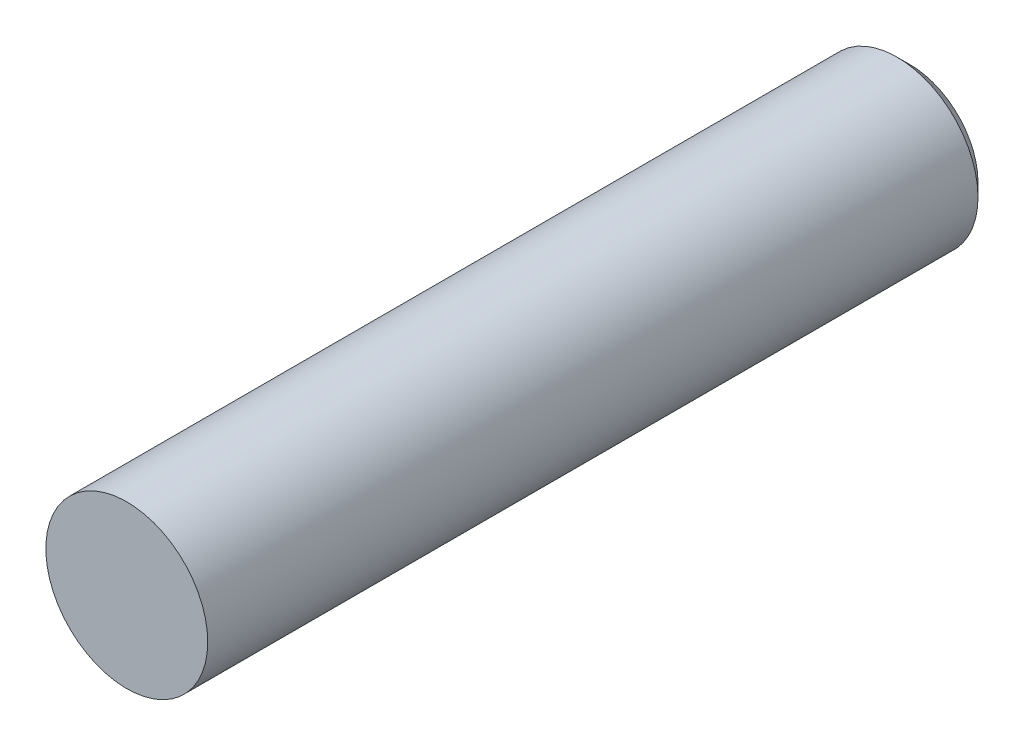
SolidWorks part; units mm, degrees
ref_plane "Plan de face" through (0, 0, 0) normal (0, 0, 1) x (1, 0, 0)
ref_plane "Plan de dessus" through (0, 0, 0) normal (0, 1, 0) x (1, 0, 0)
ref_plane "Plan de droite" through (0, 0, 0) normal (1, 0, 0) x (0, 0, -1)
sketch "Esquisse1" plane through (0, 0, 0) normal (0, 0, 1) x (1, 0, 0)
  circle A0 centre (0, 0) radius 3.1
extrude "Extrusion1" add sketch "Esquisse1" along normal blind 30
chamfer "Chanfrein2" distance 0.5 angle 45 1 edges at (3.1, 0, 0)
